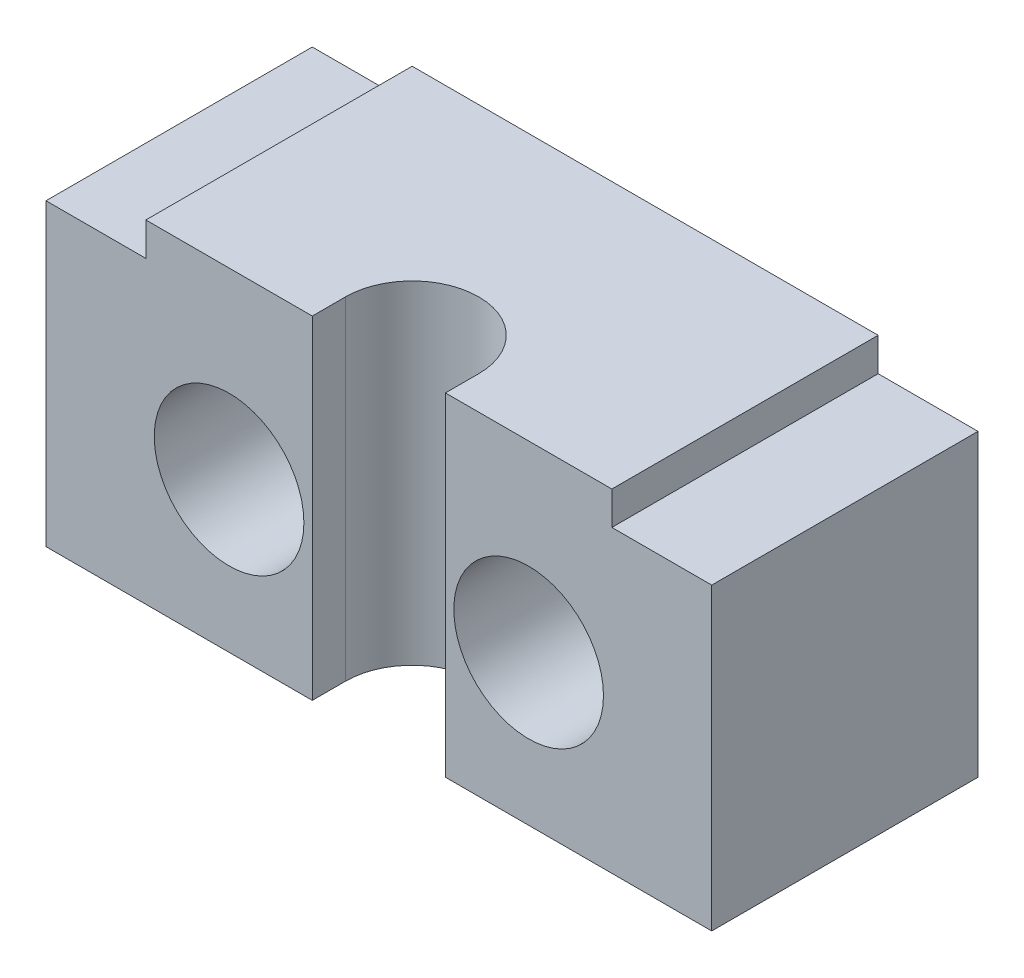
SolidWorks part; units mm, degrees
ref_plane "Front Plane" through (0, 0, 0) normal (0, 0, 1) x (1, 0, 0)
ref_plane "Top Plane" through (0, 0, 0) normal (0, 1, 0) x (1, 0, 0)
ref_plane "Right Plane" through (0, 0, 0) normal (1, 0, 0) x (0, 0, -1)
sketch "Sketch1" plane through (0, 0, 0) normal (0, 0, 1) x (1, 0, 0)
  line L0 (0, 0) -> (31.75, 0)
  line L1 (31.75, 0) -> (31.75, 28.575)
  line L2 (31.75, 28.575) -> (22.225, 28.575)
  line L3 (22.225, 28.575) -> (22.225, 31.75)
  line L4 (22.225, 31.75) -> (-22.225, 31.75)
  line L5 (-22.225, 31.75) -> (-22.225, 28.575)
  line L6 (-22.225, 28.575) -> (-31.75, 28.575)
  line L7 (-31.75, 28.575) -> (-31.75, 0)
  line L8 (-31.75, 0) -> (0, 0)
  line L9 (0, 0) -> (0, 13.8758) construction
  circle A0 centre (14.2875, 14.2748) radius 4.7625
  circle A1 centre (14.2875, 14.2748) radius 7.1374
  circle A2 centre (-14.2875, 14.2748) radius 4.7625
  circle A3 centre (-14.2875, 14.2748) radius 7.1374
  dimension "D6" = 14.2748
  dimension "D7" = 9.525
  dimension "D1" = 44.45
  dimension "D2" = 28.575
  dimension "D3" = 31.75
  dimension "D4" = 63.5
  dimension "D5" = 28.575
  dimension "D8" = 14.2748
sketch "Sketch2" plane through (0, 0, 0) normal (0, 0, 1) x (1, 0, 0)
  line L0 (-31.75, 0) -> (0, 0) construction
  line L1 (0, 0) -> (31.75, 0) construction
  line L2 (31.75, 0) -> (31.75, 28.575) construction
  line L3 (31.75, 28.575) -> (22.225, 28.575) construction
  line L4 (22.225, 28.575) -> (22.225, 31.75) construction
  line L5 (22.225, 31.75) -> (-22.225, 31.75) construction
  line L6 (-22.225, 31.75) -> (-22.225, 28.575) construction
  line L7 (-22.225, 28.575) -> (-31.75, 28.575) construction
  line L8 (-31.75, 28.575) -> (-31.75, 0) construction
  line L9 (-31.75, 0) -> (0, 0)
  line L10 (0, 0) -> (31.75, 0)
  line L11 (31.75, 0) -> (31.75, 28.575)
  line L12 (31.75, 28.575) -> (22.225, 28.575)
  line L13 (22.225, 28.575) -> (22.225, 31.75)
  line L14 (22.225, 31.75) -> (-22.225, 31.75)
  line L15 (-22.225, 31.75) -> (-22.225, 28.575)
  line L16 (-22.225, 28.575) -> (-31.75, 28.575)
  line L17 (-31.75, 28.575) -> (-31.75, 0)
  circle A0 centre (-14.2875, 14.2748) radius 4.7625 construction
  circle A1 centre (14.2875, 14.2748) radius 4.7625 construction
  circle A2 centre (-14.2875, 14.2748) radius 4.7625
  circle A3 centre (14.2875, 14.2748) radius 4.7625
extrude "Boss-Extrude1" add sketch "Sketch2" along normal blind 25.4
sketch "Sketch3" plane through (0, 0, 0) normal (0, 0, 1) x (1, 0, 0)
  circle A0 centre (14.2875, 14.2748) radius 7.1374 construction
  circle A1 centre (-14.2875, 14.2748) radius 7.1374 construction
  circle A2 centre (14.2875, 14.2748) radius 7.1374
  circle A3 centre (-14.2875, 14.2748) radius 7.1374
extrude "Cut-Extrude1" cut sketch "Sketch3" along normal blind 25.4 from offset 11.1252
sketch "Sketch4" plane through (0, 0, 0) normal (0, 1, 0) x (1, 0, 0)
  line L0 (0, 0) -> (0, -6.56) construction
  line L1 (0, -34.925) -> (0, -22.225) construction
  line L2 (-6.35, -34.925) -> (-6.35, -22.225)
  line L3 (6.35, -34.925) -> (6.35, -22.225)
  arc A0 (-6.35, -34.925) -> (6.35, -34.925) centre (0, -34.925) ccw
  arc A1 (6.35, -22.225) -> (-6.35, -22.225) centre (0, -22.225) ccw
  point P5 (0, -28.575)
  dimension "D3" = 12.7
  dimension "D1" = 22.225
  dimension "D2" = 12.7
extrude "Cut-Extrude2" cut sketch "Sketch4" along normal blind 38.1
